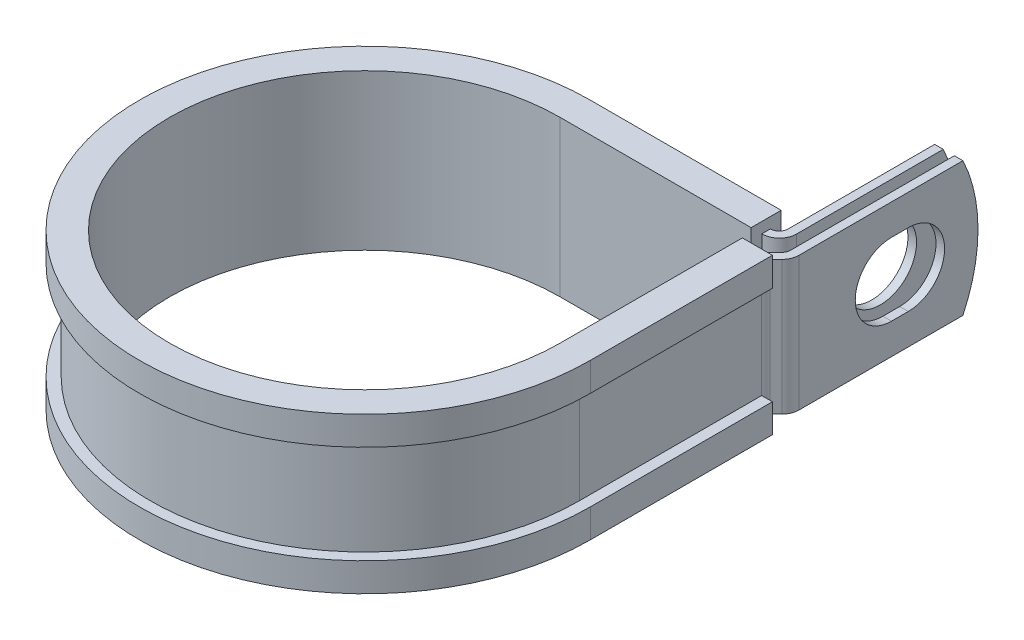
SolidWorks part; units mm, degrees
ref_plane "Front Plane" through (0, 0, 0) normal (0, 0, 1) x (1, 0, 0)
ref_plane "Top Plane" through (0, 0, 0) normal (0, 1, 0) x (1, 0, 0)
ref_plane "Right Plane" through (0, 0, 0) normal (1, 0, 0) x (0, 0, -1)
sketch "Sketch1" plane through (0, 0, 0) normal (0, 1, 0) x (1, 0, 0)
  line L0 (0, 29.2989) -> (27.1832, 29.2989)
  line L1 (29.2989, 0) -> (29.2989, 25.8864)
  line L2 (29.6216, 54.737) -> (29.6216, 31.7373)
  line L3 (30.0131, 27.6106) -> (30.8393, 28.4368)
  line L5 (31.1964, 29.2989) -> (31.1964, 54.737)
  arc A0 (0, 29.2989) -> (29.2989, 0) centre (0, 0) ccw
  arc A1 (30.0131, 27.6106) -> (29.2989, 25.8864) centre (31.7373, 25.8864) ccw
  arc A2 (30.8393, 28.4368) -> (31.1964, 29.2989) centre (29.9772, 29.2989) ccw
  arc A3 (27.1832, 29.2989) -> (29.6216, 31.7373) centre (27.1832, 31.7373) ccw
extrude "Extrude-Thin1" add sketch "Sketch1" along normal mid plane 19.05 thin
sketch "Sketch2" plane through (28.4024, 0, 0) normal (-1, 0, 0) x (0, 0, 1)
  line L0 (-54.737, 9.525) -> (-54.737, -9.525) construction
  line L1 (0, 9.525) -> (0, -9.525) construction
  circle A0 centre (-43.6372, 0) radius 5.1562
  point P2 (-54.737, 0)
extrude "Cut-Extrude1" cut sketch "Sketch2" against normal up to surface (1.2192 mm away)
sketch "Sketch3" plane through (32.4156, 0, 0) normal (1, 0, 0) x (0, 0, -1)
  line L0 (42.4434, 0) -> (44.831, 0) construction
  line L1 (42.4434, 5.1562) -> (44.831, 5.1562)
  line L2 (42.4434, -5.1562) -> (44.831, -5.1562)
  line L3 (54.737, 9.525) -> (54.737, -9.525) construction
  arc A0 (42.4434, 5.1562) -> (42.4434, -5.1562) centre (42.4434, 0) ccw
  arc A1 (44.831, -5.1562) -> (44.831, 5.1562) centre (44.831, 0) ccw
  point P3 (43.6372, 0)
  point P8 (54.737, 0)
  point P11 (37.2872, 0)
  point P12 (49.9872, 0)
extrude "Cut-Extrude2" cut sketch "Sketch3" against normal up to surface (1.2192 mm away)
sketch "Sketch4" plane through (28.4024, 0, 0) normal (-1, 0, 0) x (0, 0, 1)
  line L0 (-54.737, 9.525) -> (-54.737, -9.525)
  line L1 (-54.737, 9.525) -> (-52.5925, 9.525)
  line L2 (-54.737, 9.525) -> (-31.7373, 9.525) construction
  line L3 (-54.737, -9.525) -> (-52.5925, -9.525)
  line L4 (-54.737, -9.525) -> (-31.7373, -9.525) construction
  arc A0 (-52.5925, 9.525) -> (-52.5925, -9.525) centre (-32.512, 0) ccw
extrude "Cut-Extrude3" cut sketch "Sketch4" against normal through all contours A0 M4 M5 | A0 L0 M2
ref_plane "Plane1" through (0, 0, -25.8864) normal (0, 0, -1) x (-1, 0, 0)
ref_plane "Plane2" through (27.1324, 0, 0) normal (-1, 0, 0) x (0, 0, 1)
sketch "Sketch5" plane through (0, 0, -25.8864) normal (0, 0, -1) x (-1, 0, 0)
  line L0 (-30.5181, 9.525) -> (-29.2989, 9.525)
  line L1 (-30.5181, 9.525) -> (-30.5181, -9.525) construction
  line L3 (-29.2989, 9.525) -> (-29.2989, -9.525)
  line L4 (-29.2989, -9.525) -> (-30.5181, -9.525)
  line L5 (-30.5181, -9.525) -> (-30.5181, -6.985)
  line L6 (-30.5181, 9.525) -> (-30.5181, 6.985)
  line L7 (-32.0421, 11.049) -> (-32.0421, 6.985)
  line L8 (-32.0421, 11.049) -> (-27.7749, 11.049)
  line L9 (-27.7749, 11.049) -> (-27.7749, -11.049)
  line L10 (-27.7749, -11.049) -> (-32.0421, -11.049)
  line L11 (-32.0421, -11.049) -> (-32.0421, -6.985)
  line L12 (-32.0421, 6.985) -> (-30.5181, 6.985)
  line L13 (-30.5181, -6.985) -> (-32.0421, -6.985)
sketch "Sketch6" plane through (0, 9.525, 0) normal (0, 1, 0) x (1, 0, 0)
  line L0 (27.7749, 0) -> (27.7749, 25.8864)
  line L1 (27.7749, 25.8864) -> (32.0421, 25.8864) construction
  line L2 (27.1324, 6.9878) -> (27.1324, -6.9878) construction
  line L5 (0, 27.7749) -> (27.1324, 27.7749)
  arc A0 (0, 27.7749) -> (27.7749, 0) centre (0, 0) ccw
sweep "Sweep1" add profiles "Sketch5" path "Sketch6"
equation "\"D4@Sketch5\" = \"D1@Extrude-Thin1\""
equation "\"D5@Sketch5\" = \"D5@Extrude-Thin1\""
equation "\"D1@Sketch3\" = \"D2@Sketch2\""
equation "\"D7@Sketch1\" = \"D3@Sketch2\" + \"D1@Sketch3\""
equation "\"D1@Sketch1\" = \"D1@Sketch6\" + 2 * \"D3@Sketch5\""
equation "\"D1@Sketch4\" = ( \"D1@Extrude-Thin1\" + .125 ) * 2"
equation "\"D9@Sketch1\"= \"D5@Extrude-Thin1\""
equation "\"D8@Sketch1\"= 2 * \"D5@Extrude-Thin1\""
equation "\"D2@Sketch1\" = 2 * \"D5@Extrude-Thin1\""
equation "\"D2@Sketch3\" = \"D1@Sketch2\""
